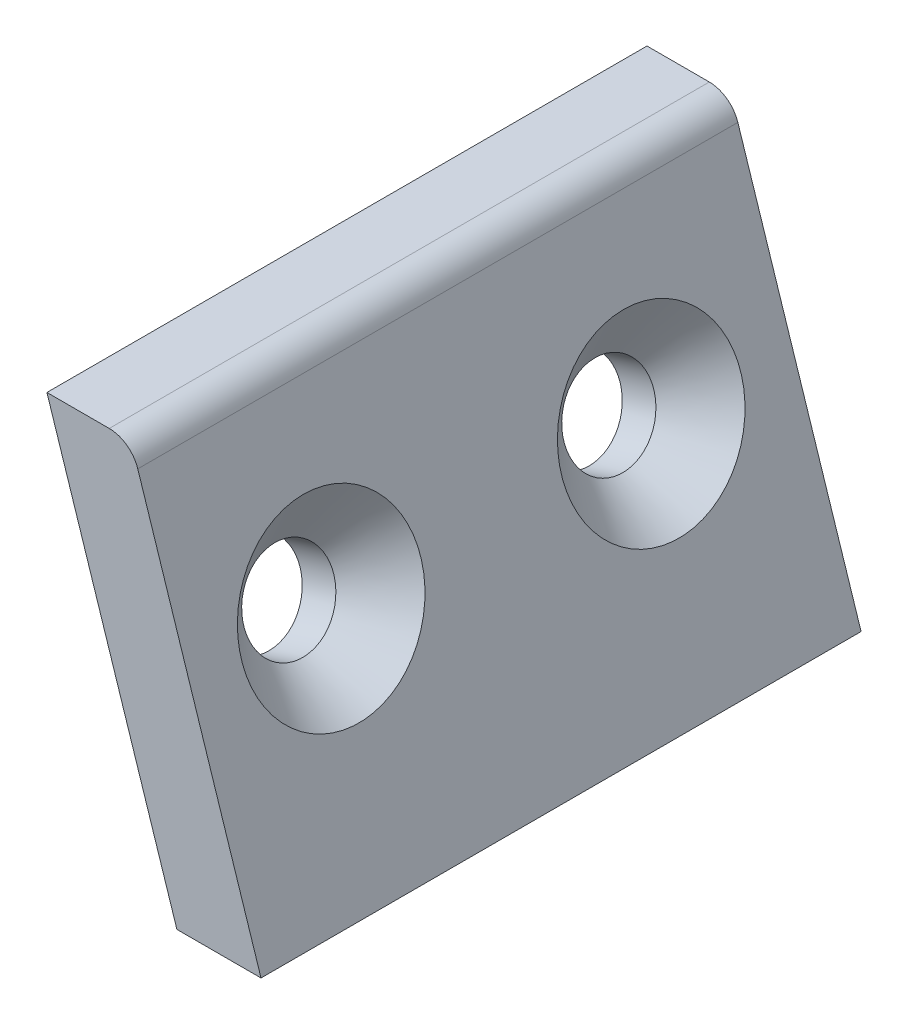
SolidWorks part; units mm, degrees
ref_plane "Plan de face" through (0, 0, 0) normal (0, 0, 1) x (1, 0, 0)
ref_plane "Plan de dessus" through (0, 0, 0) normal (0, 1, 0) x (1, 0, 0)
ref_plane "Plan de droite" through (0, 0, 0) normal (1, 0, 0) x (0, 0, -1)
sketch "Esquisse1" plane through (0, 0, 0) normal (0, 0, 1) x (1, 0, 0)
  line L0 (62.8183, -8) -> (67.0241, -8)
  line L2 (62.8183, -8) -> (56.3199, 12)
  line L3 (56.3199, 12) -> (60.5257, 12)
  line L4 (67.0241, -8) -> (60.5257, 12)
  dimension "D1" = 4
  dimension "D2" = 20
extrude "Extrusion1" add sketch "Esquisse1" against normal up to surface (30 mm away)
hole_wizard "Fraisage pour vis à tête fraisée à 6 pans creux M31" positions "Esquisse3" profile "Esquisse2" countersink size "M4" standard "ISO"
sketch "Esquisse3" plane through (58.2727, 18.934, 0) normal (0.9511, 0.309, 0) x (0, 0, -1)
  line L0 (7, -17.0204) -> (23, -17.0204) construction
  line L3 (30, -27.0204) -> (0, -27.0204) construction
  line L4 (15, -7.2908) -> (15, -28.32) construction
  line L5 (30, -7.2908) -> (0, -7.2908) construction
  line L6 (30, -28.32) -> (0, -28.32) construction
  point P1 (23, -17.0204)
  point P4 (7, -17.0204)
  point P35 (15, -17.0204)
  dimension "D1" = 10
  dimension "D2" = 16
sketch "Esquisse2" plane through (63.5323, 2.7466, -23) normal (0, 0, 1) x (-0.309, 0.9511, 0)
  line L0 (0, 0) -> (0, 10.1803)
  line L1 (0, 10.1803) -> (2.25, 10.1803)
  line L2 (2.25, 10.1803) -> (2.25, 2.23)
  line L3 (2.25, 2.23) -> (4.48, 0)
  line L5 (4.48, 0) -> (0, 0)
  line L6 (-2.25, 2.23) -> (-4.48, 0) construction
  line L11 (0, -6.35) -> (0, 107.95) construction
  dimension "Diamètre du perçage jusqu'au prochain" = 4.5
  dimension "Profondeur du perçage jusqu'au prochain" = 10.1803
  dimension "Diamètre du fraisage entrant" = 8.96
  dimension "Angle du fraisage entrant" = 90
fillet "Congé1" radius 1.5 1 edges at (60.5257, 12, -15)
